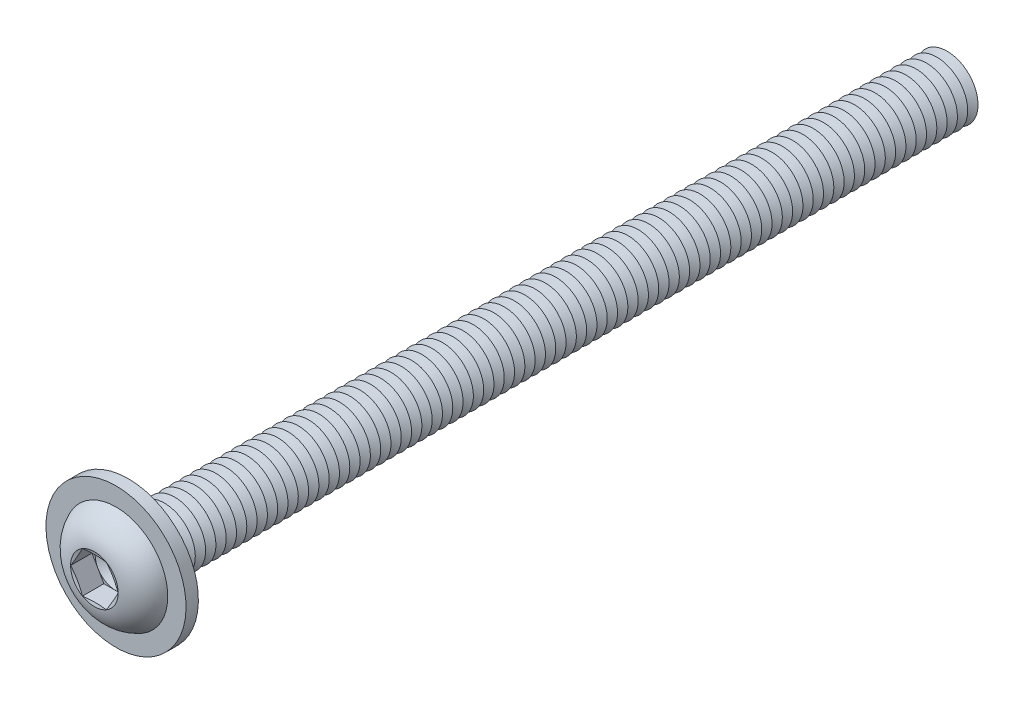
SolidWorks part; units mm, degrees
ref_plane "Front Plane" through (0, 0, 0) normal (0, 0, 1) x (1, 0, 0)
ref_plane "Top Plane" through (0, 0, 0) normal (0, 1, 0) x (1, 0, 0)
ref_plane "Right Plane" through (0, 0, 0) normal (1, 0, 0) x (0, 0, -1)
sketch "Sketch1" plane through (0, 0, 0) normal (1, 0, 0) x (0, 0, -1)
  line L0 (0, 3) -> (0, 5.25)
  line L3 (0, 3) -> (80, 3)
  line L4 (80, 3) -> (80, 0)
  line L5 (80, 0) -> (-3.3, 0) construction
  line L6 (-3.3, 0) -> (80, 0)
  line L7 (-3.3, 2.3094) -> (-3.3, 1.1547) construction
  line L8 (-3.3, 1.1547) -> (-3.3, 0)
  line L9 (-3.3, 2.3094) -> (-2.9906, 1.1547)
  line L10 (-2.9906, 1.1547) -> (-3.3, 1.1547)
  line L11 (80, 0) -> (22.7481, 0) construction
  line L12 (0, 5.25) -> (-3.3, 5.25) construction
  arc A1 (0, 5.25) -> (-3.3, 2.3094) centre (0, 1.928) ccw
  point P8 (80, 1.5)
  dimension "D1" = 10.5
  dimension "D2" = 6
  dimension "D3" = 3.3
  dimension "D4" = 4.6188
  dimension "D5" = 80
  dimension "D6" = 15
revolve "Revolve1" add sketch "Sketch1" angle 360 about L5
fillet "Fillet1" radius 0.5 1 edges at (0, 3, 0)
sketch "Sketch2" plane through (0, 0, 0) normal (1, 0, 0) x (0, 0, -1)
  line L0 (79.5, 3) -> (80.5, 3)
  line L1 (80, 3) -> (0.5, 3) construction
  line L2 (80.5, 3) -> (80, 2.134)
  line L3 (80, -3) -> (80, 3) construction
  line L4 (80, 2.134) -> (79.5, 3)
  dimension "D1" = 1
revolve "Cut-Revolve1" cut sketch "Sketch2" angle 360 about axis through (0, 0, -80) along (0, 0, -1)
pattern_linear "LPattern1" count 80 spacing 1 along (0, 0, 1) of "Cut-Revolve1"
sketch "Sketch3" plane through (0, 0, 3.3) normal (0, 0, 1) x (1, 0, 0)
  line L7 (1.1547, 2) -> (-1.1547, 2)
  line L8 (-1.1547, 2) -> (-2.3094, 0)
  line L9 (-2.3094, 0) -> (-1.1547, -2)
  line L10 (-1.1547, -2) -> (1.1547, -2)
  line L11 (1.1547, -2) -> (2.3094, 0)
  line L12 (2.3094, 0) -> (1.1547, 2)
  circle A0 centre (0, 0) radius 2 construction
  circle A3 centre (0, 0) radius 2.3094 construction
extrude "Cut-Extrude1" cut sketch "Sketch3" against normal blind 2.08
sketch "Sketch4" plane through (0, 0, 1.22) normal (0, 0, 1) x (1, 0, 0)
  line L1 (1.1547, 2) -> (-1.1547, 2) construction
  circle A0 centre (0, 0) radius 2
extrude "Cut-Extrude2" cut sketch "Sketch4" against normal through all draft 60
sketch "Sketch5" plane through (0, 0, 0) normal (0, 0, -1) x (-1, 0, 0)
  circle A0 centre (0, 0) radius 6.8
  circle A1 centre (0, 0) radius 3.5
  circle A2 centre (0, 0) radius 3.5 construction
  dimension "D1" = 13.6
extrude "Boss-Extrude1" add sketch "Sketch5" against normal blind 1.2
